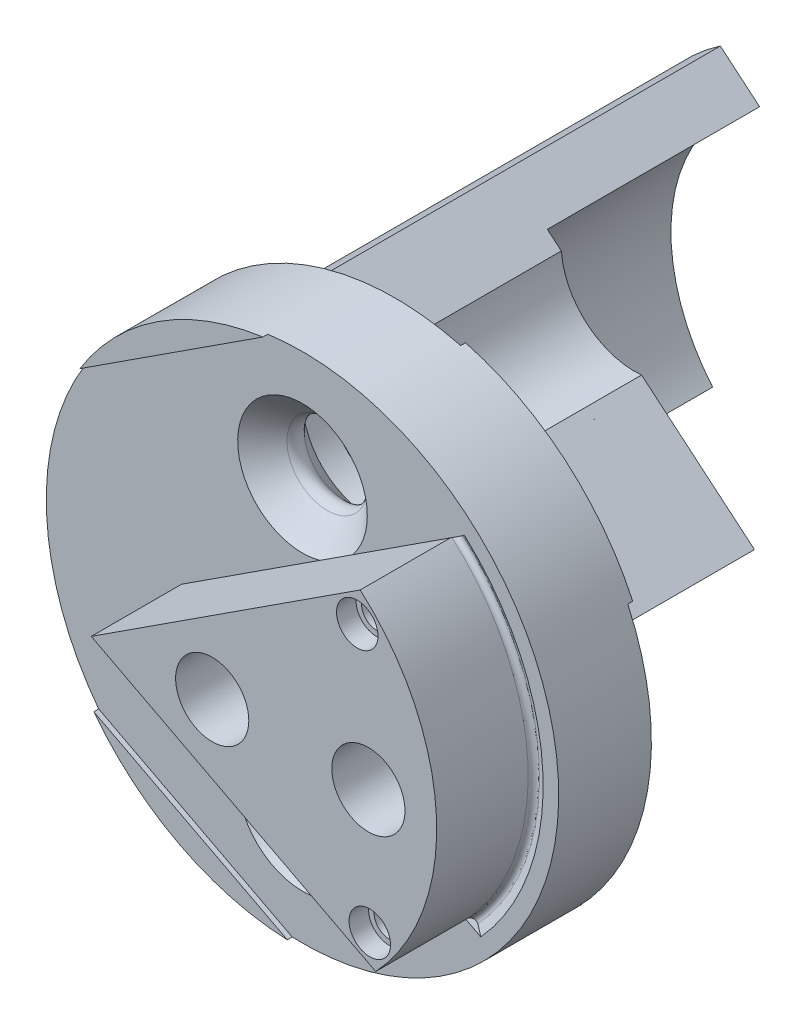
SolidWorks part; units mm, degrees
ref_plane "Front Plane" through (0, 0, 0) normal (0, 0, 1) x (1, 0, 0)
ref_plane "Top Plane" through (0, 0, 0) normal (0, 1, 0) x (1, 0, 0)
ref_plane "Right Plane" through (0, 0, 0) normal (1, 0, 0) x (0, 0, -1)
sketch "Sketch1" plane through (0, 0, 0) normal (0, 0, 1) x (1, 0, 0)
  circle A0 centre (0, 0) radius 10.5
  dimension "D1" = 21
extrude "Boss-Extrude1" add sketch "Sketch1" against normal blind 3.8
sketch "Sketch2" plane through (0, 0, 0) normal (0, 0, 1) x (1, 0, 0)
  line L0 (-4.9568, -0.2381) -> (6.0638, 6.9188)
  line L1 (-4.9568, -0.2381) -> (6.6991, -6.3058)
  line L2 (0, 0) -> (10.5, 0) construction
  arc A0 (6.6991, -6.3058) -> (6.0638, 6.9188) centre (0, 0) ccw
  circle A1 centre (0, 0) radius 2.5 construction
  circle A2 centre (0, 0) radius 10.5 construction
  dimension "D1" = 18.4
  dimension "D2" = 5
  dimension "D3" = 27.5
  dimension "D4" = 60.5
extrude "Boss-Extrude2" add sketch "Sketch2" along normal offset from surface (3.7 mm away) 7.5 contours L0 A0 L1
sketch "Sketch3" plane through (0, 0, 0) normal (0, 0, 1) x (1, 0, 0)
  line L1 (0, 0) -> (10.5, 0) construction
  line L2 (-8.7693, 5.6326) -> (2.2514, 12.7895)
  line L3 (-8.9247, 5.5317) -> (-1.4234, 10.4031)
  line L6 (-8.1891, -6.4472) -> (3.4668, -12.5148)
  line L7 (-8.3534, -6.3616) -> (-0.4198, -10.4916)
  circle A0 centre (0, 0) radius 10.5 construction
  arc A1 (-1.4234, 10.4031) -> (-8.9247, 5.5317) centre (0, 0) ccw
  arc A2 (-8.3534, -6.3616) -> (-0.4198, -10.4916) centre (0, 0) ccw
  dimension "D2" = 7
  dimension "D1" = 7
extrude "Boss-Extrude3" add sketch "Sketch3" along normal blind 0.2
sketch "Sketch14" plane through (0, 0, 0) normal (0, 0, 1) x (1, 0, 0)
  line L0 (0, 0) -> (6.2506, 0) construction
  line L1 (0, 0) -> (0, 10.5) construction
  circle A0 centre (0, 6) radius 1.5
  circle A1 centre (0, -6) radius 1.5
  arc A2 (-0.4198, -10.4916) -> (-1.4234, 10.4031) centre (0, 0) ccw construction
  dimension "D1" = 12
  dimension "D2" = 3
extrude "Cut-Extrude4" cut sketch "Sketch14" against normal up to next
sketch "Sketch6" plane through (0, 0, -3.8) normal (0, 0, -1) x (-1, 0, 0)
  line L0 (-4.924, -0.8682) -> (-0.2965, 3.0147)
  line L1 (-4.924, -0.8682) -> (7.4648, -5.3774)
  line L2 (0, 0) -> (10.5, 0) construction
  line L3 (2.9914, 5.7736) -> (5.1754, 7.6062)
  circle A0 centre (0, 0) radius 2.5 construction
  circle A1 centre (0, 0) radius 10.5 construction
  arc A2 (7.4648, -5.3774) -> (5.1754, 7.6062) centre (0, 0) ccw
  arc A3 (-0.2965, 3.0147) -> (2.9914, 5.7736) centre (0, 6) ccw
  dimension "D1" = 5
  dimension "D2" = 18.4
  dimension "D5" = 3
  dimension "D3" = 40
  dimension "D4" = 20
extrude "Boss-Extrude4" add sketch "Sketch6" along normal blind 18.5
sketch "Sketch7" plane through (0, 0, -22.3) normal (0, 0, -1) x (-1, 0, 0)
  circle A0 centre (0, 0) radius 7.2
  dimension "D1" = 14.4
extrude "Cut-Extrude3" cut sketch "Sketch7" against normal blind 8.7
sketch "Sketch8" plane through (0, 0, -3.8) normal (0, 0, -1) x (-1, 0, 0)
  line L1 (0, 0) -> (10.5, 0) construction
  line L2 (-4.7961, 8.377) -> (-9.4236, 4.4941)
  line L3 (-2.6806, 10.1521) -> (-9.5323, 4.4028)
  line L5 (-7.3182, -7.4461) -> (5.0707, -11.9553)
  line L6 (-7.4516, -7.3975) -> (0.9532, -10.4566)
  circle A0 centre (0, 0) radius 10.5 construction
  arc A1 (-2.6806, 10.1521) -> (-9.5323, 4.4028) centre (0, 0) ccw
  arc A2 (0.9532, -10.4566) -> (-7.4516, -7.3975) centre (0, 0) cw
  dimension "D2" = 7
  dimension "D1" = 7
extrude "Boss-Extrude5" add sketch "Sketch8" along normal blind 0.2
sketch "Sketch10" plane through (-1.3616, 2.0967, 0) normal (-0.5446, 0.8387, 0) x (0.8387, 0.5446, 0)
  line L0 (-6.0662, 0) -> (10.5, 0) construction
  line L1 (8.8538, 0) -> (10.0531, 0) construction
  line L2 (9.1538, 0.2232) -> (9.5404, 0)
  line L3 (-4.2868, 0) -> (8.8538, 0) construction
  line L4 (8.8538, 0) -> (9.5404, 0)
  line L5 (8.8538, -3.7) -> (8.8538, 0) construction
  line L6 (8.8538, 0) -> (8.8538, 0.05)
  line L7 (8.8538, 0.25) -> (9.5404, 0.25) construction
  arc A0 (8.8538, 0.05) -> (9.1538, 0.2232) centre (9.0538, 0.05) cw
  point P10 (8.4574, 0)
  dimension "D2" = 0.2
  dimension "D3" = 0.25
  dimension "D1" = 60
sketch "Sketch11" plane through (0, 0, 0) normal (0, 0, 1) x (1, 0, 0)
  arc A0 (6.6991, -6.3058) -> (6.0638, 6.9188) centre (0, 0) ccw construction
  arc A1 (6.6991, -6.3058) -> (6.0638, 6.9188) centre (0, 0) ccw
sketch "Sketch13" plane through (0, 0, -3.8) normal (0, 0, -1) x (-1, 0, 0)
  arc A0 (7.4648, -5.3774) -> (5.1754, 7.6062) centre (0, 0) ccw construction
  arc A1 (7.4648, -5.3774) -> (5.1754, 7.6062) centre (0, 0) ccw
sketch "Sketch15" plane through (1.607, 1.9151, 0) normal (0.6428, 0.766, 0) x (0.766, -0.6428, 0)
  line L1 (-9.5404, 3.8) -> (-9.1538, 3.5768)
  line L3 (5.9912, 3.8) -> (-10.5, 3.8) construction
  line L4 (-8.8538, 3.8) -> (-8.8538, 3.75)
  line L8 (-9.5404, 3.8) -> (-8.8538, 3.8)
  line L9 (-9.2, 22.3) -> (-9.2, 3.8) construction
  arc A0 (-8.8538, 3.75) -> (-9.1538, 3.5768) centre (-9.0538, 3.75) cw
  dimension "D1" = 0.2
  dimension "D3" = 0.25
  dimension "D2" = 60
sketch "Sketch16" plane through (0, 0, 0) normal (1, 0, 0) x (0, 0, -1)
  line L0 (0, 6) -> (4.6744, 6) construction
  line L1 (0, 7.5) -> (0, 4.5) construction
  line L2 (0, 8.6555) -> (1.0091, 7.6464)
  line L3 (1.7269, 7.6574) -> (2.7545, 8.75)
  line L4 (0, 5.5317) -> (0, 10.4031) construction
  line L5 (0, 6) -> (0, 8.6555)
  line L6 (-0.2, 5.5317) -> (-0.2, 10.4031) construction
  line L7 (2.7545, 8.75) -> (3.8, 8.75)
  line L8 (3.8, 4.4028) -> (3.8, 10.1521) construction
  line L9 (4, 4.4028) -> (4, 10.1521) construction
  line L10 (3.8, 6) -> (3.8, 8.75)
  line L11 (0, 6) -> (3.8, 6)
  circle A0 centre (3.6, 6) radius 2.5 construction
  arc A1 (1.7269, 7.6574) -> (1.0091, 7.6464) centre (1.3626, 8) cw
  circle A2 centre (-0.88, 6) radius 2.5 construction
  dimension "D1" = 45
  dimension "D3" = 6.3
  dimension "D5" = 0.5
  dimension "D7" = 5
  dimension "D6" = 3
  dimension "D2" = 7.38
  dimension "D4" = 5.5
revolve "Cut-Revolve1" cut sketch "Sketch16" angle 360 about L0
mirror "Mirror1" about plane through (0, 0, 0) normal (0, 1, 0) of "Cut-Revolve1"
sketch "Sketch4" plane through (0, 0, 3.7) normal (0, 0, 1) x (1, 0, 0)
  circle A0 centre (0, 0) radius 1.5
  dimension "D1" = 3
extrude "Cut-Extrude1" cut sketch "Sketch4" against normal up to next
sketch "Sketch5" plane through (0, 0, 3.7) normal (0, 0, 1) x (1, 0, 0)
  circle A0 centre (6.4, 0) radius 1.5
  dimension "D1" = 3
  dimension "D2" = 6.4
extrude "Cut-Extrude2" cut sketch "Sketch5" against normal up to next
hole_wizard "Ø1.7 (1.7) Diameter Hole1" positions "Sketch20" profile "Sketch21" hole size "Ø1.7" standard "DIN"
sketch "Sketch20" plane through (0, 0, 3.7) normal (0, 0, 1) x (1, 0, 0)
  line L3 (-4.4122, -1.0768) -> (6.6085, 6.0801)
  line L4 (-4.4122, -1.0768) -> (6.6085, 6.0801) construction
  line L8 (-4.4951, 0.6489) -> (7.1608, -5.4188)
  line L9 (-4.4951, 0.6489) -> (7.1608, -5.4188) construction
  circle A0 centre (0, 0) radius 8.2 construction
  point P0 (5.9441, 5.6487)
  point P2 (6.4581, -5.053)
  dimension "D3" = 16.4
  dimension "D1" = 1
  dimension "D2" = 1
sketch "Sketch21" plane through (5.9441, 5.6487, 3.7) normal (1, 0, 0) x (0, -1, 0)
  line L0 (0, 0) -> (0, 0.8)
  line L1 (0, 0.8) -> (0.85, 0.8)
  line L2 (0.85, 0.8) -> (0.85, 0)
  line L5 (0.85, 0) -> (0, 0)
  line L10 (0, 0.8) -> (-0.85, 0.8) construction
  line L11 (0, -6.35) -> (0, 107.95) construction
  dimension "Hole Dia." = 1.7
  dimension "Hole Depth" = 0.8
  dimension "Drill Angle" = 180
hole_wizard "M1.7 Tapped Hole1" positions "Sketch23" profile "Sketch22" tap size "M1.6" standard "DIN"
sketch "Sketch23" plane through (0, 0, 2.9) normal (0, 0, 1) x (1, 0, 0)
  point P0 (5.9441, 5.6487)
  point P3 (6.4581, -5.053)
sketch "Sketch22" plane through (5.9441, 5.6487, 2.9) normal (1, 0, 0) x (0, -1, 0)
  line L0 (0, 0) -> (0, 6.7)
  line L1 (0, 6.7) -> (0.625, 6.7)
  line L2 (0.625, 6.7) -> (0.625, 0)
  line L5 (0.625, 0) -> (0, 0)
  line L11 (0, -6.35) -> (0, 107.95) construction
  dimension "Thru Tap Drill Dia." = 1.25
  dimension "Thru Tap Drill Depth" = 6.7
sweep "Cut-Sweep5" cut profiles "Sketch10" path "Sketch11"
sweep "Cut-Sweep6" cut profiles "Sketch15" path "Sketch13"
hole_wizard "M1.4x0.3 Tapped Hole1" positions "Sketch26" profile "Sketch27" tap size "M1.4x0.3" standard "ANSI Metric"
sketch "Sketch26" plane through (0, 0, -22.3) normal (0, 0, -1) x (-1, 0, 0)
  line L3 (5.8182, 6.8402) -> (4.2082, 5.4892)
  line L4 (5.8182, 6.8402) -> (4.2082, 5.4892) construction
  line L8 (5.8318, -3.7189) -> (7.8068, -4.4377)
  line L9 (5.8318, -3.7189) -> (7.8068, -4.4377) construction
  line L10 (0, 0) -> (8.0754, 1.4239) construction
  line L11 (0, 0) -> (10.5, 0) construction
  circle A0 centre (0, 0) radius 8.2 construction
  arc A1 (0.9532, -10.4566) -> (-2.6806, 10.1521) centre (0, 0) ccw construction
  point P0 (7.0624, -4.1668)
  point P2 (5.2114, 6.331)
  point P30 (8.0754, 1.4239)
  dimension "D1" = 16.4
  dimension "D4" = 10
  dimension "D2" = 1
  dimension "D3" = 1
sketch "Sketch27" plane through (-7.0624, -4.1668, -22.3) normal (1, 0, 0) x (0, 1, 0)
  line L0 (0, 0) -> (0, 8.3305)
  line L1 (0, 8.3305) -> (0.55, 8)
  line L2 (0.55, 8) -> (0.55, 0)
  line L5 (0.55, 0) -> (0, 0)
  line L10 (0, 8.3305) -> (-0.55, 8) construction
  line L11 (0, -6.35) -> (0, 107.95) construction
  dimension "Tap Drill Dia." = 1.1
  dimension "Tap Drill Depth" = 8
  dimension "Drill Angle" = 118
